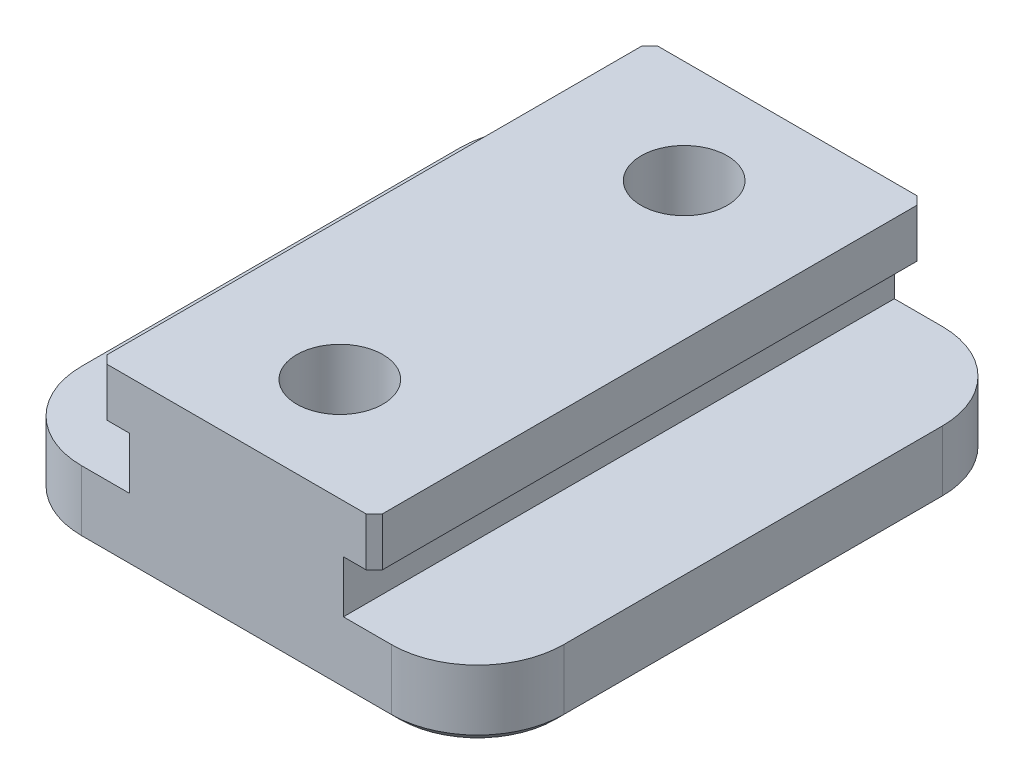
SolidWorks part; units mm, degrees
ref_plane "Front Plane" through (0, 0, 0) normal (0, 0, 1) x (1, 0, 0)
ref_plane "Top Plane" through (0, 0, 0) normal (0, 1, 0) x (1, 0, 0)
ref_plane "Right Plane" through (0, 0, 0) normal (1, 0, 0) x (0, 0, -1)
sketch "Sketch1" plane through (0, 0, 0) normal (0, 0, 1) x (1, 0, 0)
  line L0 (0, 0) -> (0, 6.3312) construction
  line L1 (12.7, 6.096) -> (-12.7, 6.096)
  line L2 (-12.7, 6.096) -> (-12.7, 1.6256)
  line L3 (-12.7, 1.6256) -> (-9.8552, 1.6256)
  line L4 (-9.8552, 1.6256) -> (-9.8552, -3.175)
  line L5 (-9.8552, -3.175) -> (-22.225, -3.175)
  line L6 (-22.225, -3.175) -> (-22.225, -9.525)
  line L7 (-22.225, -9.525) -> (22.225, -9.525)
  line L9 (22.225, -3.175) -> (22.225, -9.525)
  line L10 (9.8552, -3.175) -> (22.225, -3.175)
  line L11 (9.8552, 1.6256) -> (9.8552, -3.175)
  line L12 (12.7, 1.6256) -> (9.8552, 1.6256)
  line L13 (12.7, 6.096) -> (12.7, 1.6256)
  point P13 (0, -9.525)
  point P18 (0, 6.096)
  dimension "D1" = 25.4
  dimension "D2" = 44.45
  dimension "D3" = 6.35
  dimension "D4" = 15.621
  dimension "D5" = 4.8006
  dimension "D6" = 19.7104
  dimension "D7" = 6.096
extrude "Boss-Extrude1" add sketch "Sketch1" along normal mid plane 50.8
fillet "Fillet1" radius 7.9502 4 edges at (-22.225, -6.35, 25.4) (-22.225, -6.35, -25.4) (22.225, -6.35, -25.4) (22.225, -6.35, 25.4)
chamfer "Chamfer1" distance 0.762 angle 45 8 edges at (0, -9.525, -25.4) (-19.8964, -9.525, -23.0714) (19.8964, -9.525, -23.0714) (-22.225, -9.525, 0) (22.225, -9.525, 0) (-19.8964, -9.525, 23.0714) (19.8964, -9.525, 23.0714) (0, -9.525, 25.4)
chamfer "Chamfer3" distance 0.762 angle 45 4 edges at (12.7, 3.8608, -25.4) (-12.7, 3.8608, -25.4) (-12.7, 3.8608, 25.4) (12.7, 3.8608, 25.4)
hole_wizard " Tapped Hole1" positions "Sketch2" profile "Sketch4" tap size "3/8-16" standard "ANSI Inch"
sketch "Sketch2" plane through (0, -9.525, 0) normal (0, -1, 0) x (-1, 0, 0)
  line L0 (6.1406, 0) -> (-5.5042, 0) construction
  point P0 (0, 15.875)
  dimension "TS" = 15.875
sketch "Sketch4" plane through (0, -9.525, -15.875) normal (1, 0, 0) x (0, 0, -1)
  line L0 (0, 0) -> (0, 15.621)
  line L1 (0, 15.621) -> (3.9687, 15.621)
  line L2 (3.9687, 15.621) -> (3.9687, 0)
  line L5 (3.9687, 0) -> (0, 0)
  line L11 (0, -6.35) -> (0, 107.95) construction
  dimension "Thru Tap Drill Dia." = 7.9375
  dimension "Thru Tap Drill Depth" = 15.621
mirror "Mirror1" about plane through (0, 0, 0) normal (0, 0, 1) of " Tapped Hole1"
